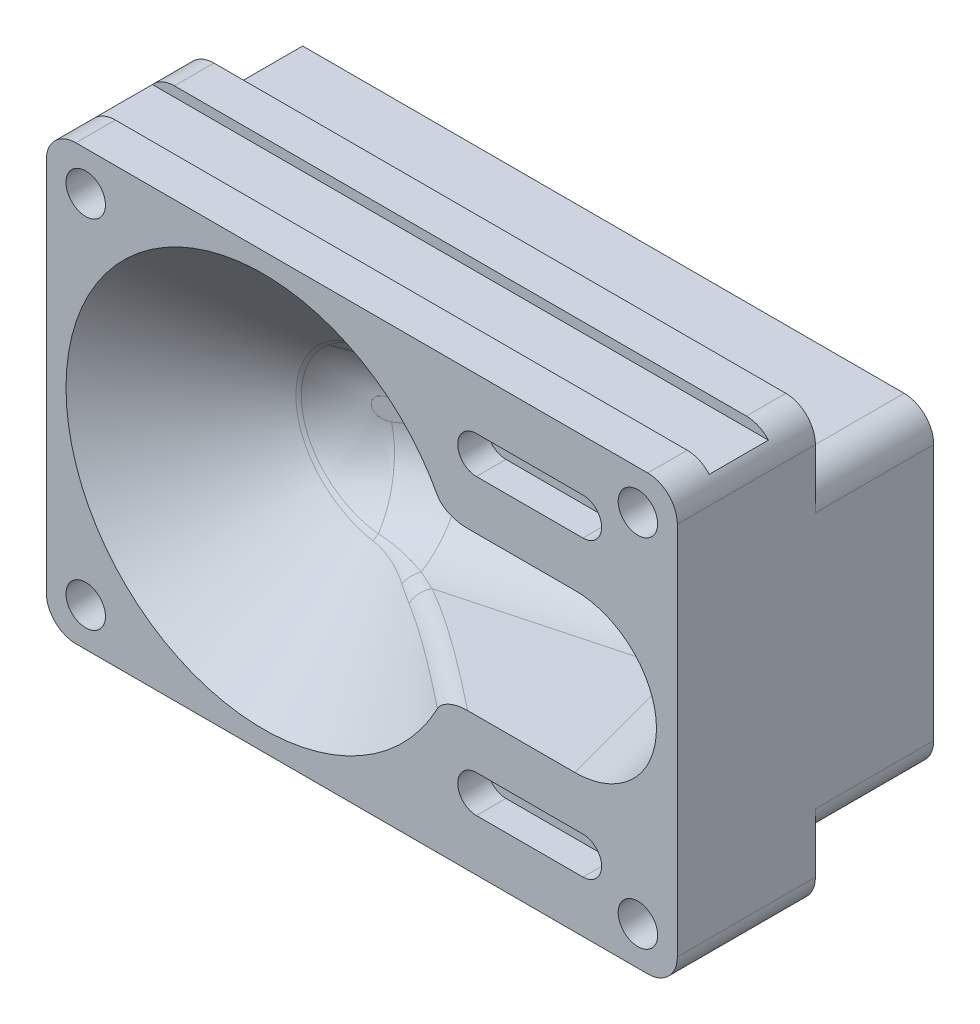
SolidWorks part; units mm, degrees
ref_plane "Top" through (0, 0, 0) normal (0, 0, 1) x (1, 0, 0)
ref_plane "Front" through (0, 0, 0) normal (0, 1, 0) x (1, 0, 0)
ref_plane "Right Side" through (0, 0, 0) normal (1, 0, 0) x (0, 0, -1)
sketch "Sketch1" plane through (0, 0, 0) normal (0, 0, 1) x (1, 0, 0)
  line L0 (0, 0) -> (203.2, 0)
  line L1 (0, 0) -> (0, 101.6)
  line L2 (203.2, 101.6) -> (0, 101.6)
  line L3 (203.2, 101.6) -> (203.2, 0)
  dimension "D1" = 101.6
  dimension "D2" = 203.2
extrude "Base-Extrude" add sketch "Sketch1" along normal blind 63.5
ref_plane "Plane4" through (0, 0, 38.1) normal (0, 0, 1) x (1, 0, 0)
sketch "Sketch3" plane through (0, 0, 38.1) normal (0, 0, 1) x (1, 0, 0)
  line L0 (0, -19.05) -> (203.2, -19.05)
  line L1 (0, -19.05) -> (0, 120.65)
  line L2 (203.2, 120.65) -> (0, 120.65)
  line L3 (203.2, 120.65) -> (203.2, -19.05)
  line L4 (0, 0) -> (203.2, 0) construction
  line L5 (203.2, 101.6) -> (203.2, 0) construction
  line L6 (0, 0) -> (0, 101.6) construction
  dimension "D2" = 139.7
  dimension "D3" = 19.05
extrude "Boss-Extrude1" add sketch "Sketch3" along normal blind 44.45
ref_plane "Plane5" through (0, 50.8, 0) normal (0, 1, 0) x (-1, 0, 0)
sketch "Sketch4" plane through (0, 50.8, 0) normal (0, 1, 0) x (-1, 0, 0)
  line L1 (-69.85, 90.5867) -> (-69.85, -8.7883) construction
  line L2 (-69.85, 41.4538) -> (-52.808, 41.4538)
  line L3 (-69.85, 90.5867) -> (-69.85, 41.4538)
  line L7 (2.7267, 90.5867) -> (-69.85, 90.5867)
  line L8 (-52.808, 41.4538) -> (2.7267, 90.5867)
revolve "Cut-Revolve3" cut sketch "Sketch4" angle 360 about L1
ref_plane "Plane9" through (20.6375, 0, 77.0202) normal (0.2588, 0, 0.9659) x (0.9659, 0, -0.2588)
ref_plane "Plane10" through (19.729, 0, 73.6295) normal (0.2588, 0, 0.9659) x (0.9659, 0, -0.2588)
sketch "Sketch6" plane through (19.729, 0, 73.6295) normal (0.2588, 0, 0.9659) x (0.9659, 0, -0.2588)
  line L0 (141.895, 76.1755) -> (52.0639, 76.1755)
  line L1 (-21.3655, -19.05) -> (-21.3655, 120.65) construction
  line L2 (50.9483, 25.4) -> (143.0106, 25.4)
  arc A0 (143.0106, 25.4) -> (141.895, 76.1755) centre (143.0106, 50.8) ccw
  arc A1 (52.0639, 76.1755) -> (50.9483, 25.4) centre (50.9483, 50.8) ccw
  dimension "D3" = 50.8
  dimension "D4" = 50.8
  dimension "D2" = 164.3761
  dimension "D5" = 72.3138
extrude "Cut-Extrude1" cut sketch "Sketch6" along normal through all
sketch "Sketch7" plane through (19.729, 0, 73.6295) normal (0.2588, 0, 0.9659) x (0.9659, 0, -0.2588)
  line L2 (72.4193, 25.4) -> (143.0106, 25.4)
  line L3 (141.895, 76.1755) -> (72.4411, 76.1755)
  line L4 (57.6883, 25.4) -> (143.0106, 25.4)
  line L5 (141.895, 76.1755) -> (57.6883, 76.1755)
  arc A0 (57.6883, 76.1755) -> (57.6883, 25.4) centre (57.6883, 50.7877) ccw
  arc A1 (143.0106, 25.4) -> (141.895, 76.1755) centre (143.0106, 50.8) ccw
  arc A2 (143.0106, 25.4) -> (141.895, 76.1755) centre (143.0106, 50.8) ccw
  ellipse E1 centre (38.6916, 50.8) end of major axis (-4.8844, 50.8) minor radius 40.1144 (72.4193, 25.4) -> (72.4411, 76.1755) ccw
  dimension "D1" = 0
extrude "Cut-Extrude2" cut sketch "Sketch7" against normal blind 24.13
fillet "Fillet8" radius 25.146 6 edges at (44.6836, 50.7877, 41.9617) (71.0302, 25.4, 42.1979) (109.875, 76.1755, 24.4938) (71.0272, 76.1755, 42.1868) (176.1499, 51.3579, 6.7355) (110.4138, 25.4, 24.3494)
fillet "Fillet9" radius 6.35 5 edges at (105.0552, 25.4, 64.7835) (46.2146, 48.7665, 47.3643)
sketch "Sketch8" plane through (0, 0, 82.55) normal (0, 0, 1) x (1, 0, 0)
  line L0 (0, -19.05) -> (0, 120.65) construction
  line L1 (0, -19.05) -> (203.2, -19.05) construction
  circle A0 centre (162.56, 50.8) radius 9.525
  dimension "D3" = 19.05
  dimension "D1" = 162.56
  dimension "D2" = 69.85
extrude "Cut-Extrude3" cut sketch "Sketch8" against normal through all
sketch "Sketch9" plane through (0, 0, 82.55) normal (0, 0, 1) x (1, 0, 0)
  line L0 (0, -19.05) -> (0, 120.65) construction
  line L1 (203.2, 120.65) -> (203.2, -19.05) construction
  line L2 (203.2, 120.65) -> (203.2, -19.05) construction
  circle A0 centre (190.5, -6.67) radius 6.35
  circle A1 centre (190.5, 108.034) radius 6.35
  circle A2 centre (12.7, -6.67) radius 6.35
  circle A3 centre (12.7, 108.034) radius 6.35
  dimension "D2" = 12.7
  dimension "D3" = 12.7
  dimension "D4" = 12.7
  dimension "D5" = 12.7
  dimension "D6" = 12.7
extrude "Cut-Extrude4" cut sketch "Sketch9" against normal blind 22.225
fillet "Fillet11" radius 9.525 6 edges at (203.2, 101.6, 19.05) (203.2, 0, 19.05) (0, 120.65, 60.325) (203.2, -19.05, 60.325) (0, -19.05, 60.325) (203.2, 120.65, 60.325)
sketch "Sketch12" plane through (0, 0, 82.55) normal (0, 0, 1) x (1, 0, 0)
  line L0 (196.4707, 50.8) -> (145.8397, 50.8) construction
  line L1 (138.4833, 104.0673) -> (172.8145, 104.0673)
  line L3 (172.8145, 92.075) -> (138.4833, 92.075)
  line L5 (138.4833, -2.4673) -> (172.8145, -2.4673)
  line L7 (172.8145, 9.525) -> (138.4833, 9.525)
  arc A0 (172.8145, 104.0673) -> (172.8145, 92.075) centre (172.8145, 98.0712) cw
  arc A1 (172.8145, -2.4673) -> (172.8145, 9.525) centre (172.8145, 3.5288) ccw
  arc A2 (138.4833, 104.0673) -> (138.4833, 92.075) centre (138.4833, 98.0712) ccw
  arc A3 (138.4833, -2.4673) -> (138.4833, 9.525) centre (138.4833, 3.5288) cw
  ellipse E0 centre (170.1747, 50.8) end of major axis (143.8786, 50.8) minor radius 25.4 (170.1747, 25.4) -> (169.0197, 76.1755) ccw construction
extrude "Cut-Extrude5" cut sketch "Sketch12" against normal blind 9.525
sketch "Sketch13" plane through (0, 120.65, 0) normal (0, 1, 0) x (-1, 0, 0)
  line L0 (7.0823, 69.85) -> (-216.8766, 69.85)
  line L1 (7.0823, 69.85) -> (7.0823, 50.8)
  line L2 (-216.8766, 50.8) -> (7.0823, 50.8)
  line L3 (-216.8766, 50.8) -> (-216.8766, 69.85)
  line L4 (-193.675, 38.1) -> (-9.525, 38.1) construction
  line L5 (-193.675, 82.55) -> (-9.525, 82.55) construction
  dimension "D1" = 12.7
  dimension "D2" = 12.7
extrude "Cut-Extrude6" cut sketch "Sketch13" against normal blind 3.175
sketch "Sketch14" plane through (0, -19.05, 0) normal (0, -1, 0) x (1, 0, 0)
  line L0 (-10.5717, 69.85) -> (216.1218, 69.85)
  line L1 (-10.5717, 69.85) -> (-10.5717, 50.8)
  line L2 (216.1218, 50.8) -> (-10.5717, 50.8)
  line L3 (216.1218, 50.8) -> (216.1218, 69.85)
  line L4 (9.525, 82.55) -> (193.675, 82.55) construction
  line L5 (9.525, 38.1) -> (193.675, 38.1) construction
  dimension "D1" = 12.7
  dimension "D2" = 12.7
extrude "Cut-Extrude7" cut sketch "Sketch14" against normal blind 3.175
